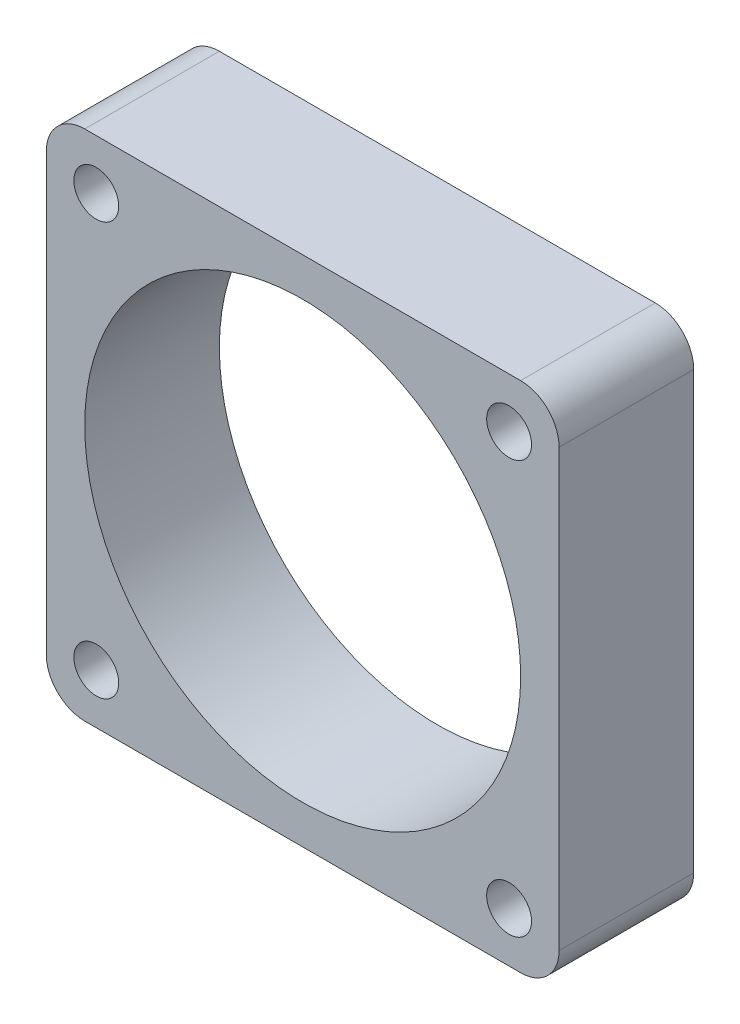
SolidWorks part; units mm, degrees
ref_plane "前视基准面" through (0, 0, 0) normal (0, 0, 1) x (1, 0, 0)
ref_plane "上视基准面" through (0, 0, 0) normal (0, 1, 0) x (1, 0, 0)
ref_plane "右视基准面" through (0, 0, 0) normal (1, 0, 0) x (0, 0, -1)
sketch "草图1" plane through (0, 0, 0) normal (0, 0, 1) x (1, 0, 0)
  line L1 (3, 0) -> (37, 0)
  line L2 (0, 3) -> (0, 37)
  line L3 (3, 40) -> (37, 40)
  line L4 (40, 3) -> (40, 37)
  arc A0 (37, 0) -> (40, 3) centre (37, 3) ccw
  arc A1 (0, 37) -> (3, 40) centre (3, 37) cw
  arc A2 (37, 40) -> (40, 37) centre (37, 37) cw
  arc A3 (3, 0) -> (0, 3) centre (3, 3) cw
  point P7 (40, 0)
  point P12 (40, 40)
  point P15 (0, 0)
  dimension "D3" = 3
  dimension "D1" = 40
  dimension "D2" = 40
extrude "凸台-拉伸1" add sketch "草图1" along normal blind 10.5
sketch "草图2" plane through (0, 0, 10.5) normal (0, 0, 1) x (1, 0, 0)
  line L0 (0, 37) -> (0, 3) construction
  line L2 (37, 40) -> (3, 40) construction
  circle A0 centre (3.9, 36.1) radius 1.75
  circle A1 centre (36.1, 36.1) radius 1.75
  circle A2 centre (3.9, 3.9) radius 1.75
  circle A3 centre (36.1, 3.9) radius 1.75
  dimension "D1" = 3.5
  dimension "D2" = 3.5
  dimension "D3" = 3.5
  dimension "D4" = 3.5
  dimension "D5" = 32.2
  dimension "D6" = 3.9
  dimension "D7" = 3.9
  dimension "D8" = 32.2
extrude "切除-拉伸1" cut sketch "草图2" against normal through all
sketch "草图3" plane through (0, 0, 10.5) normal (0, 0, 1) x (1, 0, 0)
  line L0 (40, 3) -> (40, 37) construction
  line L3 (37, 40) -> (3, 40) construction
  circle A0 centre (20, 20) radius 17
  point P6 (20.1357, 40)
  point P7 (36.4836, 22.8843)
  point P8 (18.7142, 40)
  dimension "D3" = 34
  dimension "D1" = 20
  dimension "D2" = 20
extrude "切除-拉伸2" cut sketch "草图3" against normal up to next
